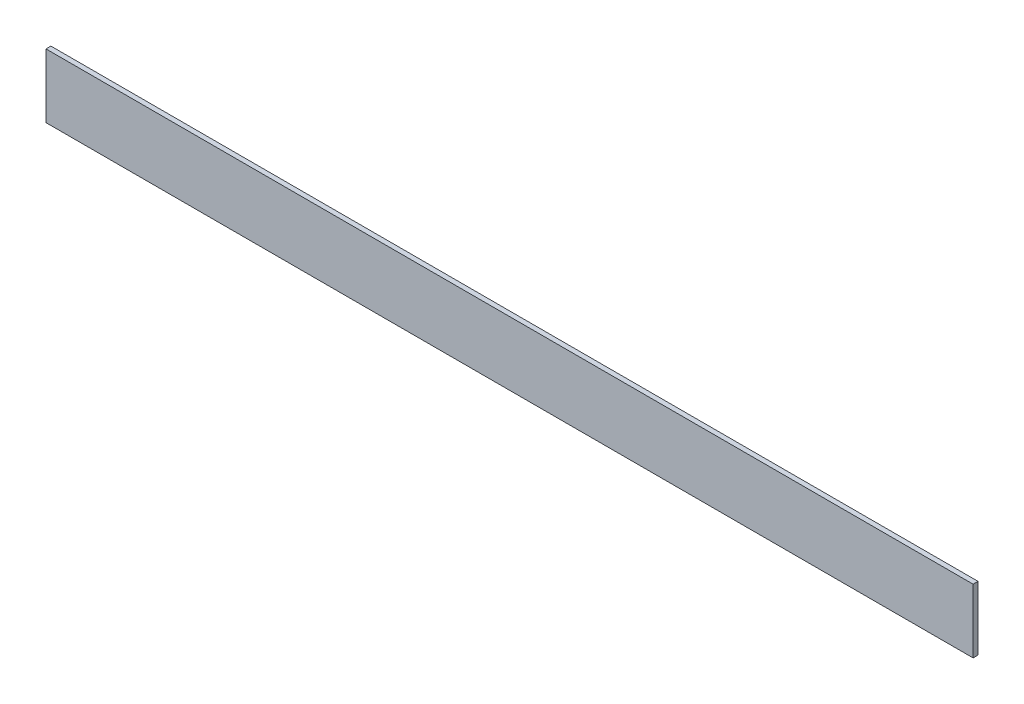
SolidWorks part; units mm, degrees
ref_plane "前视基准面" through (0, 0, 0) normal (0, 0, 1) x (1, 0, 0)
ref_plane "上视基准面" through (0, 0, 0) normal (0, 1, 0) x (1, 0, 0)
ref_plane "右视基准面" through (0, 0, 0) normal (1, 0, 0) x (0, 0, -1)
sketch "草图1" plane through (0, 0, 0) normal (0, 0, 1) x (1, 0, 0)
  line L1 (-283, -19.5) -> (283, -19.5)
  line L2 (-283, -19.5) -> (-283, 19.5)
  line L3 (-283, 19.5) -> (283, 19.5)
  line L4 (283, -19.5) -> (283, 19.5)
  line L5 (-283, -19.5) -> (283, 19.5) construction
  line L6 (-283, 19.5) -> (283, -19.5) construction
  point P0 (0, 0)
  dimension "D1" = 39
  dimension "D2" = 566
extrude "凸台-拉伸1" add sketch "草图1" along normal blind 3
